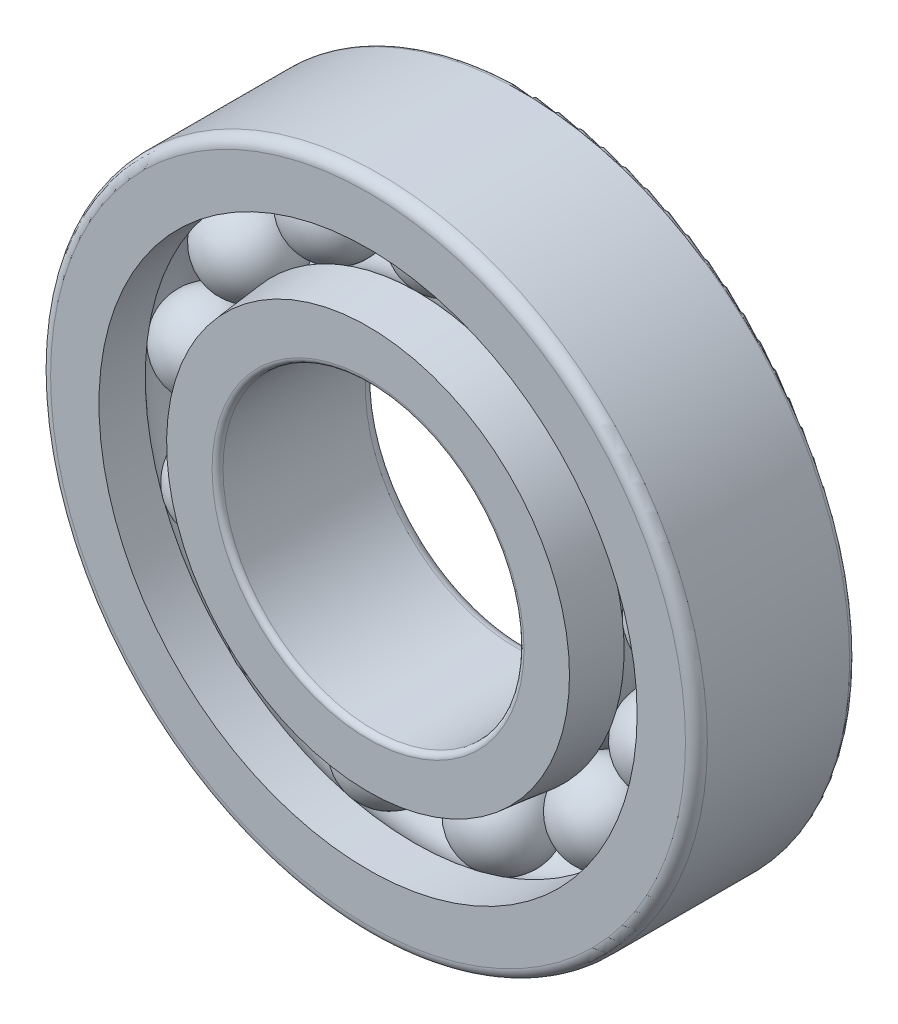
SolidWorks part; units mm, degrees
ref_plane "Front Plane" through (0, 0, 0) normal (0, 0, 1) x (1, 0, 0)
ref_plane "Top Plane" through (0, 0, 0) normal (0, 1, 0) x (1, 0, 0)
ref_plane "Right Plane" through (0, 0, 0) normal (1, 0, 0) x (0, 0, -1)
other "Configuration Table"
sketch "BaseSke" plane through (0, 0, 0) normal (1, 0, 0) x (0, 0, -1)
  line L0 (-47.2296, 0) -> (24.6132, 0) construction
  line L1 (-47.2296, 43.75) -> (24.6132, 43.75) construction
  line L2 (0, 129.5214) -> (0, -86.3012) construction
  line L3 (0, 51.875) -> (0, 35.625)
  line L4 (-14.5, 60) -> (14.5, 60) construction
  line L5 (-14.5, 27.5) -> (14.5, 27.5) construction
  arc A0 (0, 51.875) -> (0, 35.625) centre (0, 43.75) ccw
revolve "Ball" add sketch "BaseSke" angle 360 about L3
sketch "OuterRaceSke" plane through (0, 0, 0) normal (1, 0, 0) x (0, 0, -1)
  line L0 (0, 0) -> (0, 87.5396) construction
  line L1 (-14.5, 60) -> (14.5, 60)
  line L2 (-14.5, 60) -> (-14.5, 49.1667)
  line L3 (-14.5, 49.1667) -> (-6.0426, 49.1667)
  line L4 (14.5, 60) -> (14.5, 50.6907)
  line L5 (-50.3916, 0) -> (55.2197, 0) construction
  line L6 (-47.2296, 43.75) -> (24.6132, 43.75) construction
  line L8 (14.5, 50.6907) -> (5.4727, 49.7419)
  line L9 (0, 49.1667) -> (-2.5325, 58.6181) construction
  line L10 (0, 49.1667) -> (5.4727, 49.7419) construction
  arc A0 (5.4727, 49.7419) -> (-6.0426, 49.1667) centre (0, 43.75) ccw
revolve "OuterRace" add sketch "OuterRaceSke" angle 360 about L5
sketch "InnerRaceSke" plane through (0, 0, 0) normal (1, 0, 0) x (0, 0, -1)
  line L0 (-70.8626, 0) -> (113.5527, 0) construction
  line L1 (0, 58.441) -> (0, -70.8113) construction
  line L2 (-14.5, 27.5) -> (14.5, 27.5)
  line L3 (-14.5, 27.5) -> (-14.5, 38.3333)
  line L4 (-14.5, 38.3333) -> (-6.0426, 38.3333)
  line L5 (14.5, 27.5) -> (14.5, 38.3333)
  line L6 (0, 129.5214) -> (0, -86.3012) construction
  line L7 (6.0426, 38.3333) -> (14.5, 38.3333)
  arc A0 (-6.0426, 38.3333) -> (6.0426, 38.3333) centre (0, 43.75) ccw
  arc A1 (0, 51.875) -> (0, 35.625) centre (0, 43.75) ccw construction
revolve "InnerRace" add sketch "InnerRaceSke" angle 360 about L0
fillet "Fillet1" radius 2 2 edges at (27.5, 0, -14.5) (60, 0, 14.5)
fillet "Fillet2" radius 1 2 edges at (60, 0, -14.5) (27.5, 0, 14.5)
sketch "CutInnerRaceSke" plane through (0, 0, 0) normal (1, 0, 0) x (0, 0, -1)
  line L0 (-6.0426, 38.3333) -> (-14.5, 38.3333)
  line L1 (-14.5, 38.3333) -> (-14.5, 36.8093)
  line L2 (-14.5, 36.8093) -> (-5.4727, 37.7581)
  line L3 (-5.4727, 37.7581) -> (0, 38.3333) construction
  line L4 (0, 58.441) -> (0, -70.8113) construction
  line L5 (-28.3066, 0) -> (35.2466, 0) construction
  arc A0 (-6.0426, 38.3333) -> (-5.4727, 37.7581) centre (0, 43.75) ccw
  arc A1 (-6.0426, 38.3333) -> (6.0426, 38.3333) centre (0, 43.75) ccw construction
revolve "CutInnerRace" cut sketch "CutInnerRaceSke" angle 360 about L5
pattern_circular "CirPatternBall" count 13 over 360 about axis through (0, 0, 0) along (0, 0, 1) of "Ball"
sketch "SimplifiedSke" plane through (0, 0, 0) normal (1, 0, 0) x (0, 0, -1)
  line L0 (37.5911, 0) -> (-37.5911, 0) construction
  circle A0 centre (0, 43.75) radius 8.125
  arc A1 (0, 51.875) -> (0, 35.625) centre (0, 43.75) ccw construction
revolve "Simplified" [suppressed] add sketch "SimplifiedSke" angle 360 about L0
equation "\"D1@BaseSke\" =  (\"Bearing_Outside_Diameter@BaseSke\"  +  \"Bearing_Inside_Diameter@BaseSke\"  )  / 4"
equation "\"Ball_diameter@BaseSke\" =  ( \"Bearing_Outside_Diameter@BaseSke\" - \"Bearing_Inside_Diameter@BaseSke\" ) / 4 "
equation "\"D2@OuterRaceSke\" = \"Bearing_Outside_Diameter@BaseSke\" -  ( \"Bearing_Outside_Diameter@BaseSke\" - \"Bearing_Inside_Diameter@BaseSke\" )  / 3"
equation "\"D4@OuterRaceSke\" = (  \"Bearing_Outside_Diameter@BaseSke\" - \"Bearing_Inside_Diameter@BaseSke\" ) / 4 -0.02"
equation "\"D3@OuterRaceSke\" = \"Angle@OuterRaceSke\"/2.5"
equation "\"D1@InnerRaceSke\" = \"Bearing_Inside_Diameter@BaseSke\" +  ( \"Bearing_Outside_Diameter@BaseSke\" - \"Bearing_Inside_Diameter@BaseSke\" )  / 3"
equation "\"D2@InnerRaceSke\" = \"D4@OuterRaceSke\""
equation "\"D1@CirPatternBall\" = int( \"D1@BaseSke\"* pi  * 2 / \"Ball_diameter@BaseSke\"/1.2 ) -1"
equation "\"D1@CutInnerRaceSke\" = \"D3@OuterRaceSke\""
